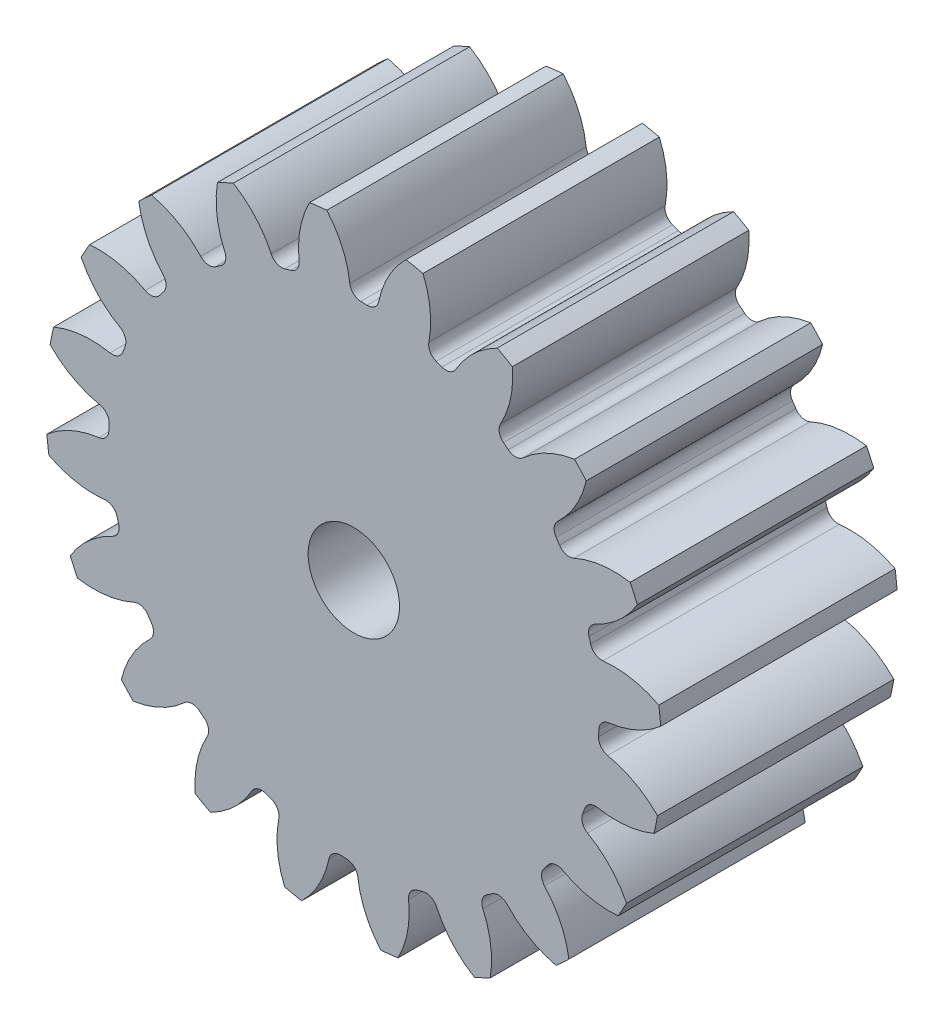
SolidWorks part; units mm, degrees
ref_plane "Front" through (0, 0, 0) normal (0, 0, 1) x (1, 0, 0)
ref_plane "Top" through (0, 0, 0) normal (0, 1, 0) x (1, 0, 0)
ref_plane "Right" through (0, 0, 0) normal (1, 0, 0) x (0, 0, -1)
sketch "Sketch3" plane through (0, 0, 0) normal (0, 0, 1) x (1, 0, 0)
  circle A0 centre (0, 0) radius 124.1778
  dimension "od" = 248.3556
extrude "gearBody" add sketch "Sketch3" along normal blind 95.25
sketch "Sketch2" plane through (0, 0, 0) normal (0, 0, 1) x (1, 0, 0)
  line L0 (0, 0) -> (98.0059, 40.5954) construction
  line L1 (122.8318, -21.4516) -> (0, 0) construction
  line L2 (0, 0) -> (36.3143, 0) construction
  line L3 (112.8104, 4.2086) -> (112.0847, -13.4511) construction
  line L5 (112.4475, -4.6212) -> (0, 0) construction
  line L7 (0, 0) -> (106.0809, 0) construction
  arc A0 (106.0591, 2.1465) -> (105.5254, -10.842) centre (0, 0) ccw construction
  arc A1 (123.7002, 10.8805) -> (122.3902, -20.994) centre (0, 0) ccw construction
  arc A2 (112.8104, 4.2086) -> (112.0847, -13.4511) centre (0, 0) ccw construction
  arc A3 (98.6363, -5.2847) -> (98.7373, -2.8267) centre (0, 0) ccw
  arc A4 (122.8318, -21.4516) -> (102.2945, -10.0301) centre (94.3444, -48.5004) ccw
  arc A5 (122.8318, -21.4516) -> (124.1778, 11.3003) centre (0, 0) ccw
  arc A6 (124.1778, 11.3003) -> (102.7725, 1.6025) centre (98.0059, 40.5954) cw
  arc A7 (98.7373, -2.8267) -> (102.7725, 1.6025) centre (103.33, -2.9582) cw
  arc A8 (102.2945, -10.0301) -> (98.6363, -5.2847) centre (103.2243, -5.5305) cw
  point P6 (124.1778, 11.3003)
  point P22 (122.8318, -21.4516)
  dimension "baseDia" = 212.1617
  dimension "od" = 248.3556
  dimension "pd" = 225.7778
  dimension "rd" = 197.5556
  dimension "rFillet" = 4.5946
  dimension "pointX" = 124.1778
  dimension "pointY" = 11.3003
  dimension "CTT" = 17.6597
  dimension "flankCenterAngle" = 22.5
extrude "toothCut" cut sketch "Sketch2" along normal through all
pattern_circular "CirPattern1" count 20 over 360 about axis through (0, 0, 0) along (0, 0, 1) of "toothCut"
sketch "hub1Dia" plane through (0, 0, 0) normal (0, 0, -1) x (-1, 0, 0)
  circle A0 centre (0, 0) radius 12.7
  dimension "hub1Dia" = 25.4
sketch "hub2Dia" plane through (0, 0, 95.25) normal (0, 0, 1) x (1, 0, 0)
  circle A0 centre (0, 0) radius 12.7
  dimension "hub2dia" = 25.4
sketch "boreDia" plane through (0, 0, 0) normal (0, 0, 1) x (1, 0, 0)
  circle A0 centre (0, 0) radius 18.415
  dimension "boreDia" = 36.83
extrude "bore" cut sketch "boreDia" against normal mid plane 25400
